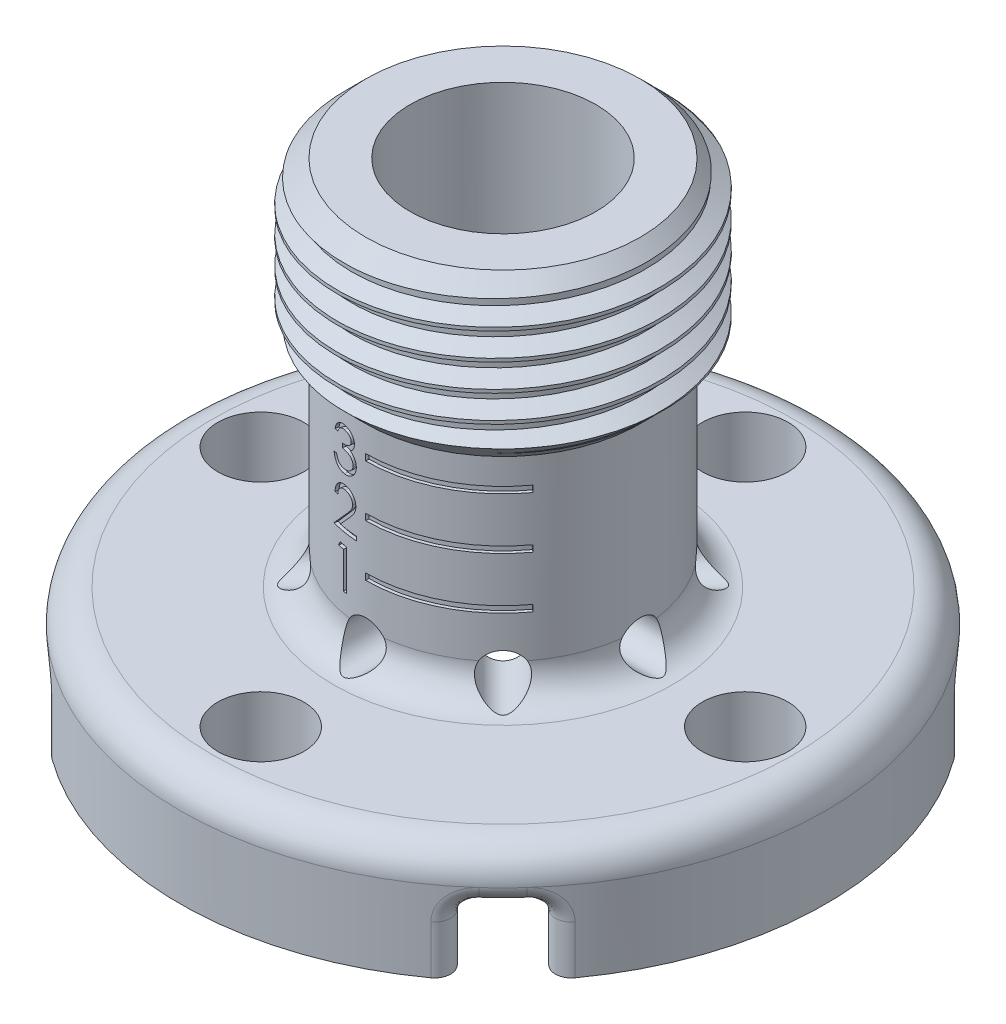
SolidWorks part; units mm, degrees
ref_plane "Front" through (0, 0, 0) normal (0, 0, 1) x (1, 0, 0)
ref_plane "Top" through (0, 0, 0) normal (0, 1, 0) x (1, 0, 0)
ref_plane "Right" through (0, 0, 0) normal (1, 0, 0) x (0, 0, -1)
sketch "Sketch2" plane through (0, 0, 0) normal (0, 0, 1) x (1, 0, 0)
  line L0 (0, 0) -> (0, 23.6717) construction
  line L1 (7.3025, 38.1) -> (7.3025, 0)
  line L2 (7.3025, 0) -> (25.4, 0)
  line L3 (25.4, 0) -> (25.4, 8.89)
  line L4 (25.4, 8.89) -> (10.795, 8.89)
  line L5 (10.795, 8.89) -> (10.795, 25.4)
  line L6 (10.795, 38.1) -> (7.3025, 38.1)
  line L7 (19.05, 8.89) -> (19.05, 0) construction
  line L10 (7.3025, 9.017) -> (10.795, 9.017) construction
  line L15 (7.3025, 12.192) -> (10.795, 12.192) construction
  line L16 (10.795, 9.017) -> (10.795, 12.192) construction
  line L17 (10.795, 38.1) -> (12.7, 36.195)
  line L18 (12.7, 36.195) -> (12.7, 27.305)
  line L19 (12.7, 27.305) -> (10.795, 25.4)
  point P18 (10.795, 10.6045)
  dimension "D1" = 14.605
  dimension "D2" = 8.89
  dimension "D3" = 45
  dimension "D4" = 38.1
  dimension "D5" = 50.8
  dimension "D6" = 38.1
  dimension "D7" = 25.4
  dimension "D8" = 3.4925
  dimension "D9" = 3.175
  dimension "D10" = 0.127
  dimension "D11" = 12.7
  dimension "D12" = 1.905
revolve "Revolve1" add sketch "Sketch2" angle 360 about L0
sketch "Sketch3" plane through (0, 8.89, 0) normal (0, 1, 0) x (1, 0, 0)
  point P0 (19.05, 0)
chamfer "Chamfer1" distance 2.54 angle 45 1 edges at (0, 0, -7.3025)
thread "Thread1" pitch 2.1167 start angle 0, offset 2.54, length 0, pitch 2.1167, diameter 25.4
ref_plane "Plane1" through (-12.7, 38.735, 0) normal (0, 0, 1) x (-1, 0, 0)
sketch "Thread Profile1" plane through (-12.7, 38.735, 0) normal (0, 0, 1) x (-1, 0, 0)
  line L0 (0, 0) -> (0, 2.1167) construction
  line L11 (0, 0) -> (0, 1.8521)
  line L12 (0, 1.8521) -> (-1.1457, 1.1906)
  line L13 (-1.1457, 1.1906) -> (-1.1457, 0.6615)
  line L15 (-1.1457, 0.6615) -> (0, 0)
  line L17 (-1.1457, 0.926) -> (0, 0.926) construction
  point P2 (0, 0)
  dimension "Pitch" = 2.1167
  dimension "Profile_Angle" = 60
  dimension "Profile_Land" = 0.5292
  dimension "Profile_Height" = 1.1457
fillet "Fillet2" radius 2.54 1 edges at (0, 8.89, -10.795)
fillet "Fillet3" radius 2.54 1 edges at (0, 8.89, -25.4)
hole_wizard "1/4 Clearance Hole1" positions "Sketch3" profile "Sketch4" hole size "1/4" standard "ANSI Inch"
sketch "Sketch4" plane through (19.05, 8.89, 0) normal (1, 0, 0) x (0, 0, 1)
  line L0 (0, 0) -> (0, 8.89)
  line L1 (0, 8.89) -> (3.3782, 8.89)
  line L2 (3.3782, 8.89) -> (3.3782, 0)
  line L5 (3.3782, 0) -> (0, 0)
  line L11 (0, -6.35) -> (0, 107.95) construction
  dimension "Thru Hole Dia." = 6.7564
  dimension "Thru Hole Depth" = 8.89
pattern_circular "CirPattern1" count 4 over 360 about axis through (0, 0, 0) along (0, 1, 0) of "1/4 Clearance Hole1"
sketch "Sketch8" plane through (0, 0, 0) normal (1, 0, 0) x (0, 0, -1)
  point P0 (0, 10.6045)
hole_wizard "1/8 (0.125) Diameter Hole1" positions "Sketch8" profile "Sketch9" hole size "1/8" standard "ANSI Inch"
sketch "Sketch9" plane through (0, 10.6045, 0) normal (0, 1, 0) x (0, 0, 1)
  line L0 (0, 0) -> (0, 25.4)
  line L1 (0, 25.4) -> (1.5875, 25.4)
  line L2 (1.5875, 25.4) -> (1.5875, 0)
  line L5 (1.5875, 0) -> (0, 0)
  line L11 (0, -6.35) -> (0, 107.95) construction
  dimension "Thru Hole Dia." = 3.175
  dimension "Thru Hole Depth" = 25.4
pattern_circular "CirPattern2" count 8 over 360 about axis through (0, 0, 0) along (0, 1, 0) of "1/8 (0.125) Diameter Hole1"
sketch "Sketch10" plane through (0, 0, 0) normal (0, 1, 0) x (1, 0, 0)
  line L0 (25.1447, 28.7368) -> (-1.7961, 1.7961)
  line L1 (-1.7961, 1.7961) -> (1.7961, -1.7961)
  line L2 (1.7961, -1.7961) -> (28.7368, 25.1447)
  line L3 (28.7368, 25.1447) -> (25.1447, 28.7368)
  line L5 (7.5728, 7.5728) -> (5.0402, 5.0402) construction
  point P6 (0, 0)
  dimension "D1" = 5.08
  dimension "D2" = 38.1
extrude "Cut-Extrude1" cut sketch "Sketch10" along normal blind 5.08
pattern_circular "CirPattern3" count 4 over 360 about axis through (0, 0, 0) along (0, 1, 0) of "Cut-Extrude1"
fillet "Fillet1" radius 1.27 36 edges at (5.1636, 5.08, -5.1636) (17.9605, 5.08, -17.9605) (16.0744, 2.54, -19.6665) (3.0452, 3.81, -6.6373) (19.6665, 2.54, -16.0744) (6.6373, 3.81, -3.0452) (9.5598, 5.08, -13.1519) (13.1519, 5.08, -9.5598) (-5.1636, 5.08, -5.1636) (-5.1636, 5.08, 5.1636) (5.1636, 5.08, 5.1636) (-17.9605, 5.08, 17.9605) (-17.9605, 5.08, -17.9605) (17.9605, 5.08, 17.9605) (13.1519, 5.08, 9.5598) (9.5598, 5.08, 13.1519) (-13.1519, 5.08, -9.5598) (-9.5598, 5.08, -13.1519) (19.6665, 2.54, 16.0744) (6.6373, 3.81, 3.0452) (16.0744, 2.54, 19.6665) (3.0452, 3.81, 6.6373) (-16.0744, 2.54, -19.6665) (-3.0452, 3.81, -6.6373) (-9.5598, 5.08, 13.1519) (-13.1519, 5.08, 9.5598) (-16.0744, 2.54, 19.6665) (-3.0452, 3.81, 6.6373) (-19.6665, 2.54, 16.0744) (-6.6373, 3.81, 3.0452) (-19.6665, 2.54, -16.0744) (-6.6373, 3.81, -3.0452)
sketch "Sketch12" plane through (0, 0, 0) normal (0, 0, 1) x (1, 0, 0)
  line L0 (-3.048, 12.954) -> (0, 12.954) construction
  line L1 (0, 25.4) -> (0, 11.43) construction
  line L2 (-3.048, 17.018) -> (0, 17.018) construction
  line L3 (-3.048, 21.082) -> (0, 21.082) construction
  line L4 (-3.048, 12.954) -> (-3.048, 17.018) construction
  line L5 (-3.048, 17.018) -> (-3.048, 21.082) construction
  line L6 (-3.048, 21.082) -> (-3.048, 25.146) construction
  line L7 (22.86, 8.89) -> (-22.86, 8.89) construction
  line L9 (0, 15.24) -> (10.16, 15.24)
  line L10 (0, 15.24) -> (0, 14.732)
  line L11 (0, 14.732) -> (10.16, 14.732)
  line L12 (10.16, 15.24) -> (10.16, 14.732)
  line L13 (0, 19.304) -> (10.16, 19.304)
  line L14 (0, 19.304) -> (0, 18.796)
  line L15 (0, 18.796) -> (10.16, 18.796)
  line L16 (10.16, 19.304) -> (10.16, 18.796)
  line L17 (0, 23.368) -> (10.16, 23.368)
  line L18 (0, 23.368) -> (0, 22.86)
  line L19 (0, 22.86) -> (10.16, 22.86)
  line L20 (10.16, 23.368) -> (10.16, 22.86)
  text T0 "1"
  text T1 "2"
  text T2 "3"
  point P20 (0, 19.05)
  point P21 (-3.048, 19.05)
  point P22 (0, 14.986)
  point P23 (-3.048, 14.986)
  point P29 (0, 23.114)
  point P30 (-3.048, 23.114)
  dimension "D1" = 4.064
  dimension "D2" = 4.064
  dimension "D3" = 3.048
  dimension "D4" = 10.16
  dimension "D5" = 0.508
wrap "Wrap1" sketch "Sketch12" wrap type deboss source sketch "Sketch12" thickness 0.254 parameters "D1"=0.254
